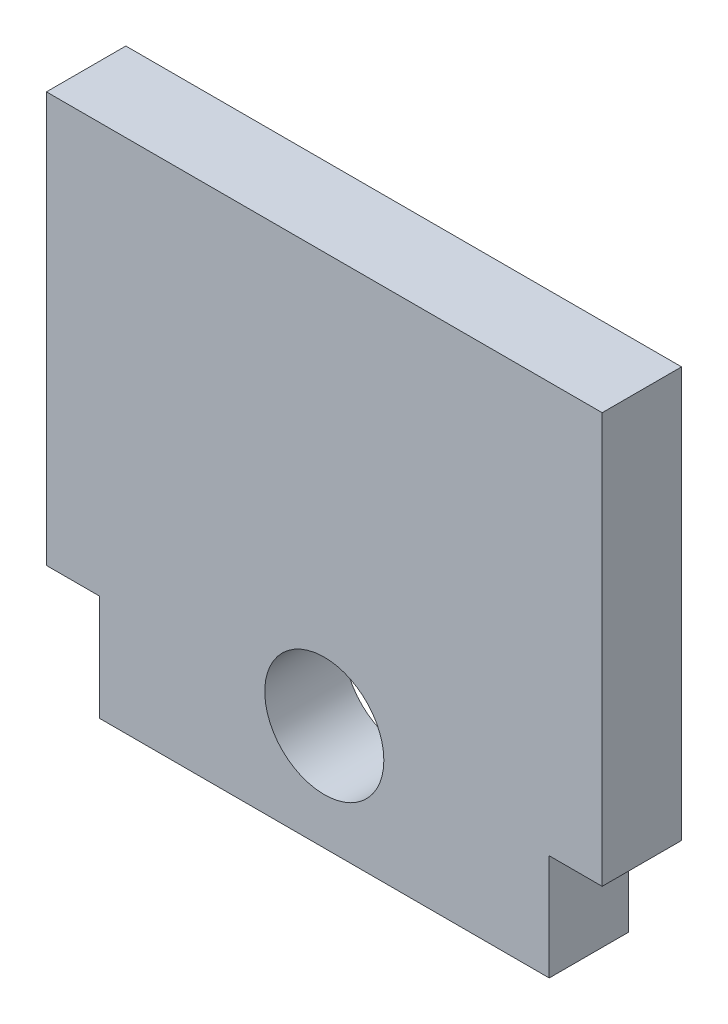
SolidWorks part; units mm, degrees
ref_plane "Front Plane" through (0, 0, 0) normal (0, 0, 1) x (1, 0, 0)
ref_plane "Top Plane" through (0, 0, 0) normal (0, 1, 0) x (1, 0, 0)
ref_plane "Right Plane" through (0, 0, 0) normal (1, 0, 0) x (0, 0, -1)
sketch "Sketch1" plane through (0, 0, 0) normal (0, 0, 1) x (1, 0, 0)
  line L0 (0, 0) -> (0, 8)
  line L1 (0, 8) -> (-4, 8)
  line L2 (-4, 8) -> (-4, 39)
  line L3 (-4, 39) -> (38, 39)
  line L4 (38, 39) -> (38, 8)
  line L5 (38, 8) -> (34, 8)
  line L6 (34, 8) -> (34, 0)
  line L7 (34, 0) -> (0, 0)
  line L8 (17, 0) -> (17, 39) construction
  circle A0 centre (17, 8) radius 4.5
  dimension "D7" = 9
  dimension "D8" = 8
  dimension "D1" = 4
  dimension "D2" = 4
  dimension "D3" = 42
  dimension "D4" = 39
  dimension "D5" = 8
  dimension "D6" = 8
extrude "Boss-Extrude1" add sketch "Sketch1" along normal blind 6
